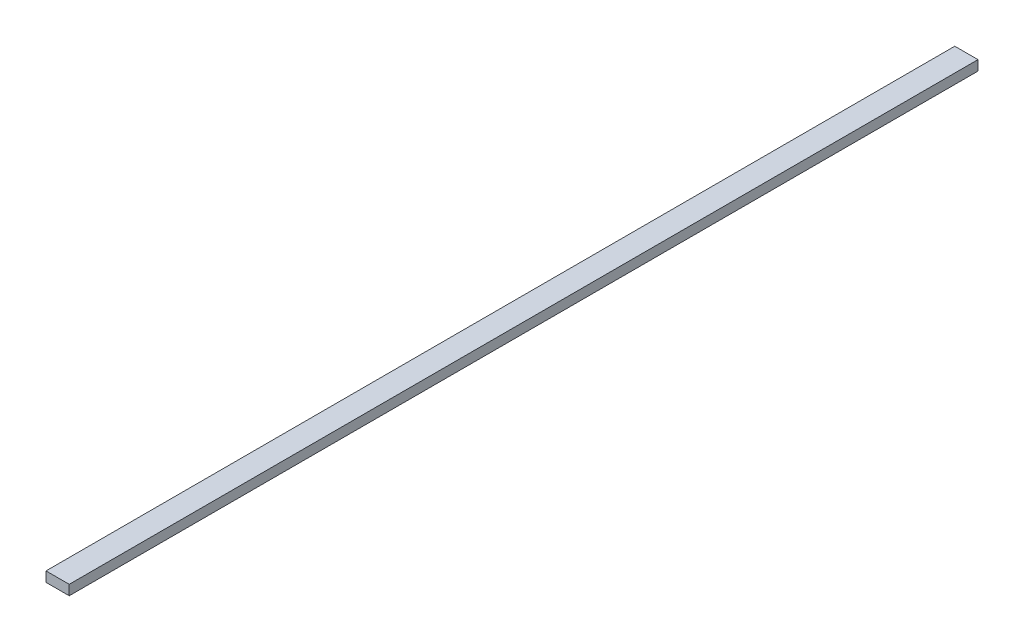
SolidWorks part; units mm, degrees
ref_plane "Front Plane" through (0, 0, 0) normal (0, 0, 1) x (1, 0, 0)
ref_plane "Top Plane" through (0, 0, 0) normal (0, 1, 0) x (1, 0, 0)
ref_plane "Right Plane" through (0, 0, 0) normal (1, 0, 0) x (0, 0, -1)
sketch "Sketch1" plane through (0, 0, 0) normal (0, 1, 0) x (1, 0, 0)
  line L0 (0, 0) -> (0, -3479.8)
  line L1 (0, -3479.8) -> (-88.9, -3479.8)
  line L2 (-88.9, -3479.8) -> (-88.9, 0)
  line L3 (-88.9, 0) -> (0, 0)
  dimension "D1" = 3479.8
  dimension "D3" = 88.9
extrude "Boss-Extrude1" add sketch "Sketch1" along normal blind 38.1
